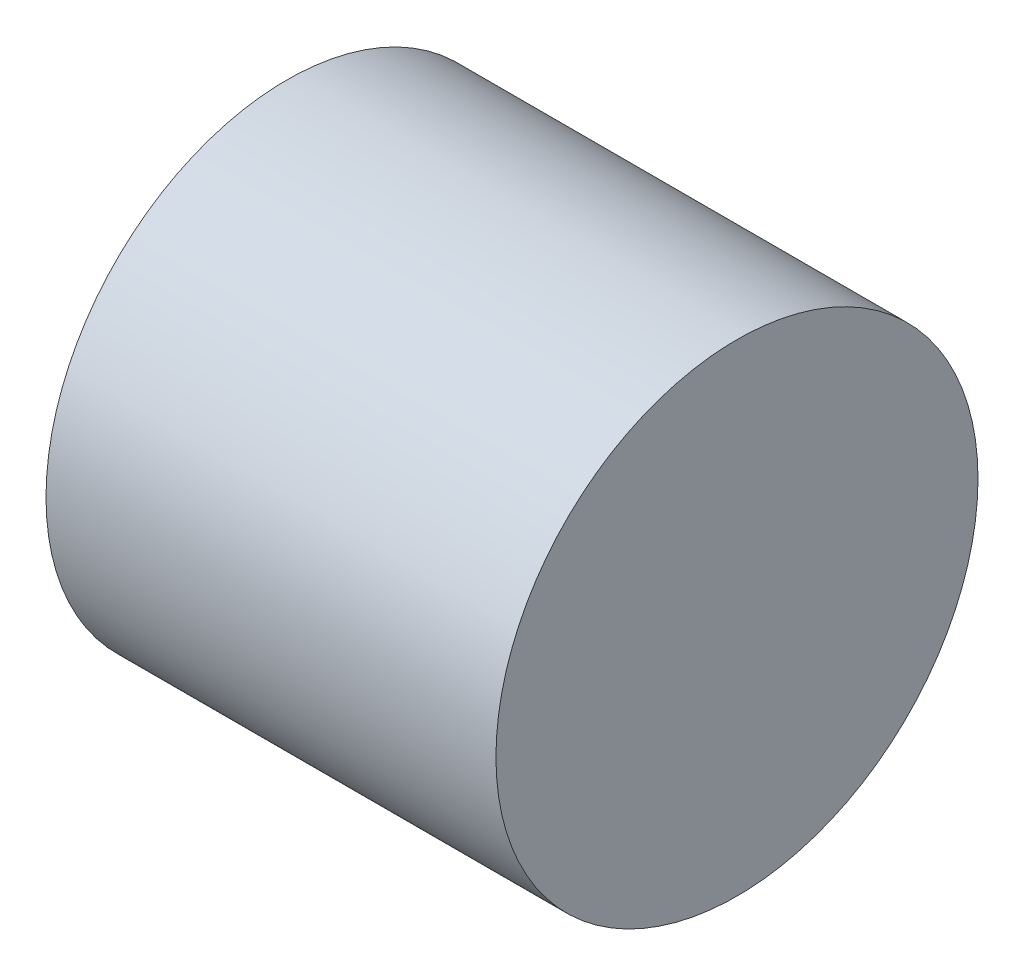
SolidWorks part; units mm, degrees
ref_plane "Front Plane" through (0, 0, 0) normal (0, 0, 1) x (1, 0, 0)
ref_plane "Top Plane" through (0, 0, 0) normal (0, 1, 0) x (1, 0, 0)
ref_plane "Right Plane" through (0, 0, 0) normal (1, 0, 0) x (0, 0, -1)
sketch "Sketch1" plane through (0, 0, 0) normal (0, 0, 1) x (1, 0, 0)
  line L0 (0, 0) -> (58.0654, 0) construction
  line L2 (0, 0) -> (14, 0)
  line L3 (0, 0) -> (0, 7.5)
  line L4 (0, 7.5) -> (14, 7.5)
  line L5 (14, 0) -> (14, 7.5)
  dimension "D1" = 15
  dimension "D2" = 14
revolve "Revolve1" add sketch "Sketch1" angle 360 about L0
hole_wizard "Ø8.0 (8) Diameter Hole1" positions "3DSketch2" profile "Sketch3" hole size "Ø8.0" standard "Ansi Metric"
sketch3d "3DSketch2"
  circle A0 centre (0, 0, 0) radius 7.5 construction
  point P0 (0, 0, 0)
  point P4 (0, 0, 0)
  point P10 (-7.5, 0, 0)
sketch "Sketch3" plane through (0, 0, 0) normal (0, 1, 0) x (0, 0, 1)
  line L0 (0, 0) -> (0, 12.3094)
  line L1 (0, 12.3094) -> (4, 10)
  line L2 (4, 10) -> (4, 0)
  line L5 (4, 0) -> (0, 0)
  line L10 (0, 12.3094) -> (-4, 10) construction
  line L11 (0, -6.35) -> (0, 107.95) construction
  dimension "Hole Dia." = 8
  dimension "Hole Depth" = 10
  dimension "Drill Angle" = 120
